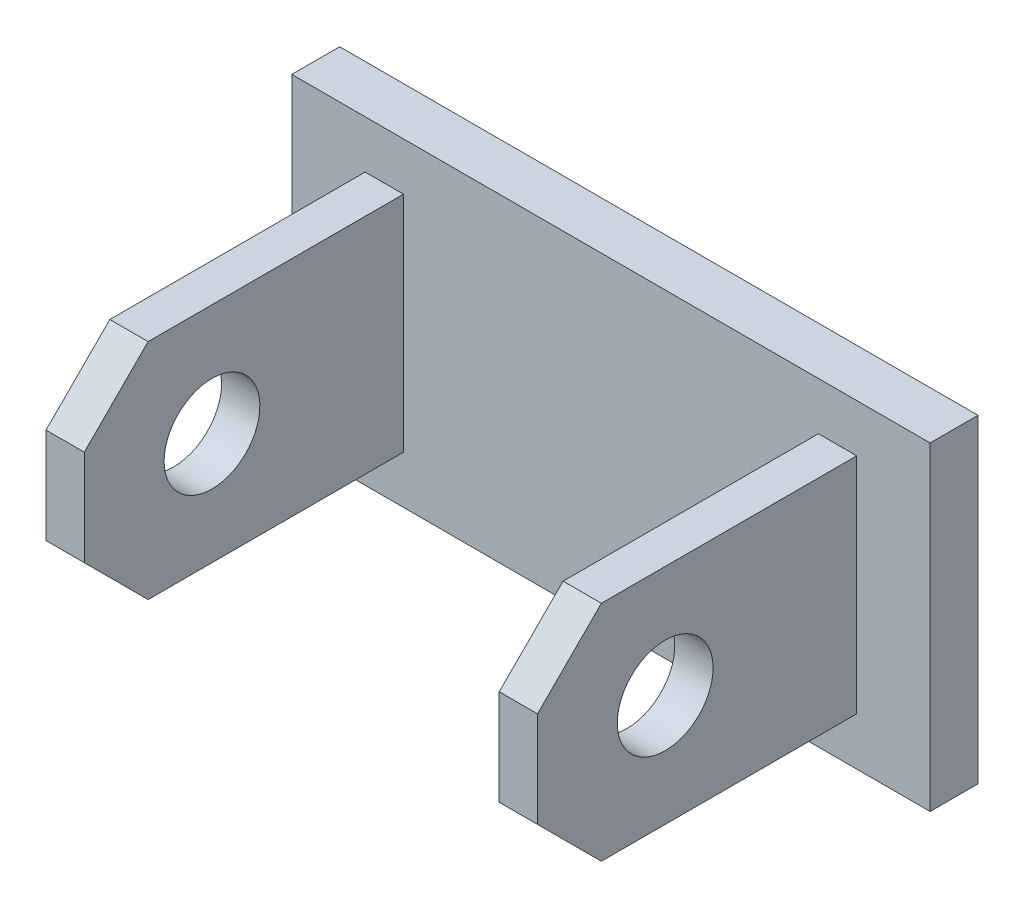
SolidWorks part; units mm, degrees
ref_plane "Płaszczyzna przednia" through (0, 0, 0) normal (0, 0, 1) x (1, 0, 0)
ref_plane "Płaszczyzna górna" through (0, 0, 0) normal (0, 1, 0) x (1, 0, 0)
ref_plane "Płaszczyzna prawa" through (0, 0, 0) normal (1, 0, 0) x (0, 0, -1)
sketch "Szkic1" plane through (0, 0, 0) normal (0, 0, 1) x (1, 0, 0)
  line L1 (100, -50) -> (-100, -50)
  line L2 (100, -50) -> (100, 50)
  line L3 (100, 50) -> (-100, 50)
  line L4 (-100, -50) -> (-100, 50)
  line L5 (100, -50) -> (-100, 50) construction
  line L6 (100, 50) -> (-100, -50) construction
  point P0 (0, 0)
  dimension "D1" = 100
  dimension "D2" = 200
extrude "Dodanie-wyciągnięcie1" add sketch "Szkic1" along normal blind 15
sketch "Szkic2" plane through (0, 0, 15) normal (0, 0, 1) x (1, 0, 0)
  line L0 (-65, 0) -> (65, 0) construction
  line L2 (-77, 35) -> (-65, 35)
  line L3 (-77, 35) -> (-77, -35)
  line L4 (-77, -35) -> (-65, -35)
  line L5 (-65, 35) -> (-65, -35)
  dimension "D1" = 130
  dimension "D2" = 12
  dimension "D3" = 70
extrude "Dodanie-wyciągnięcie2" add sketch "Szkic2" along normal blind 100 separate body
chamfer "Sfazowanie1" distance 20 angle 45 2 edges at (-71, -35, 115) (-71, 35, 115)
sketch "Szkic3" plane through (-77, 0, 0) normal (-1, 0, 0) x (0, 0, 1)
  circle A0 centre (75, 0) radius 15
  dimension "D1" = 30
  dimension "D2" = 75
extrude "Wytnij-wyciągnięcie1" cut sketch "Szkic3" against normal through all
mirror "Lustro1" about plane through (0, 0, 0) normal (1, 0, 0)
